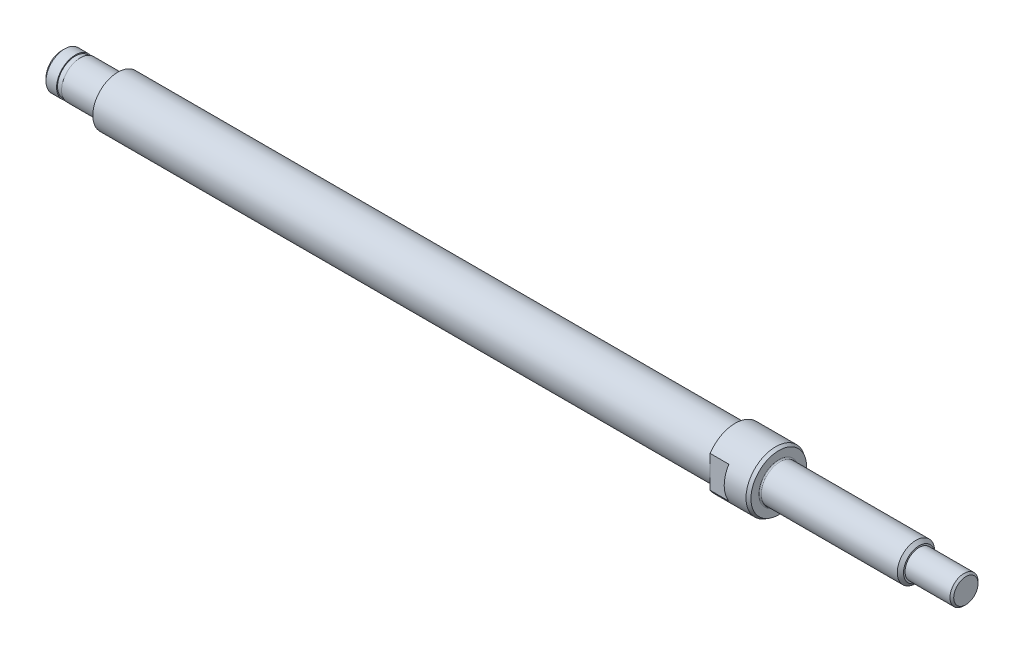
SolidWorks part; units mm, degrees
ref_plane "Front Plane" through (0, 0, 0) normal (0, 0, 1) x (1, 0, 0)
ref_plane "Top Plane" through (0, 0, 0) normal (0, 1, 0) x (1, 0, 0)
ref_plane "Right Plane" through (0, 0, 0) normal (1, 0, 0) x (0, 0, -1)
ref_plane "Plane1" through (0, 0, 0) normal (0, 0, 1) x (1, 0, 0)
sketch "Sketch1" plane through (0, 0, 0) normal (0, 0, 1) x (1, 0, 0)
  line L0 (0, 0) -> (0, 4)
  line L1 (0, 4) -> (99, 4)
  line L2 (99, 4) -> (99, 4.75)
  line L3 (99, 4.75) -> (105.5, 4.75)
  line L4 (105.5, 4.75) -> (106, 4.4613)
  line L5 (106, 4.4613) -> (106, 3.2)
  line L6 (106.2, 3) -> (128, 3)
  line L7 (128, 3) -> (128.5, 2.5)
  line L8 (128.5, 2.5) -> (128.5, 2.25)
  line L9 (128.5, 2.25) -> (135.7, 2.25)
  line L10 (135.7, 2.25) -> (136, 1.95)
  line L11 (136, 1.95) -> (136, 0)
  line L12 (136, 0) -> (0, 0)
  line L13 (136, 0) -> (0, 0) construction
  arc A0 (106, 3.2) -> (106.2, 3) centre (106.2, 3.2) ccw
revolve "Revolve1" add sketch "Sketch1" angle 360 about L13
ref_plane "Plane2" through (0, 0, 0) normal (0, 0, 1) x (1, 0, 0)
sketch "Sketch2" plane through (0, 0, 0) normal (0, 0, 1) x (1, 0, 0)
  line L0 (-9, 0) -> (-9, 2.5)
  line L1 (-9, 2.5) -> (-8.5, 3)
  line L2 (-8.5, 3) -> (-6.8, 3)
  line L3 (-6.8, 3) -> (-6.8, 2.85)
  line L4 (-6.8, 2.85) -> (-6, 2.85)
  line L5 (-6, 2.85) -> (-6, 3)
  line L6 (-6, 3) -> (-0.2, 3)
  line L7 (0, 3.2) -> (0, 0)
  line L8 (0, 0) -> (-9, 0)
  line L9 (0, 0) -> (-9, 0) construction
  arc A0 (-0.2, 3) -> (0, 3.2) centre (-0.2, 3.2) ccw
revolve "Revolve2" add sketch "Sketch2" angle 360 about L9
ref_plane "Plane3" through (102, 0, 0) normal (1, 0, 0) x (0, 0, -1)
sketch "Sketch3" plane through (102, 0, 0) normal (1, 0, 0) x (0, 0, -1)
  line L0 (-8, 9.5) -> (-8, -9.5)
  line L1 (-8, -9.5) -> (8, -9.5)
  line L2 (8, -9.5) -> (8, 9.5)
  line L3 (8, 9.5) -> (-8, 9.5)
  line L4 (-4, 4.85) -> (-4, -4.85)
  line L5 (-4, -4.85) -> (4, -4.85)
  line L6 (4, -4.85) -> (4, 4.85)
  line L7 (4, 4.85) -> (-4, 4.85)
extrude "Cut-Extrude1" cut sketch "Sketch3" against normal blind 3
